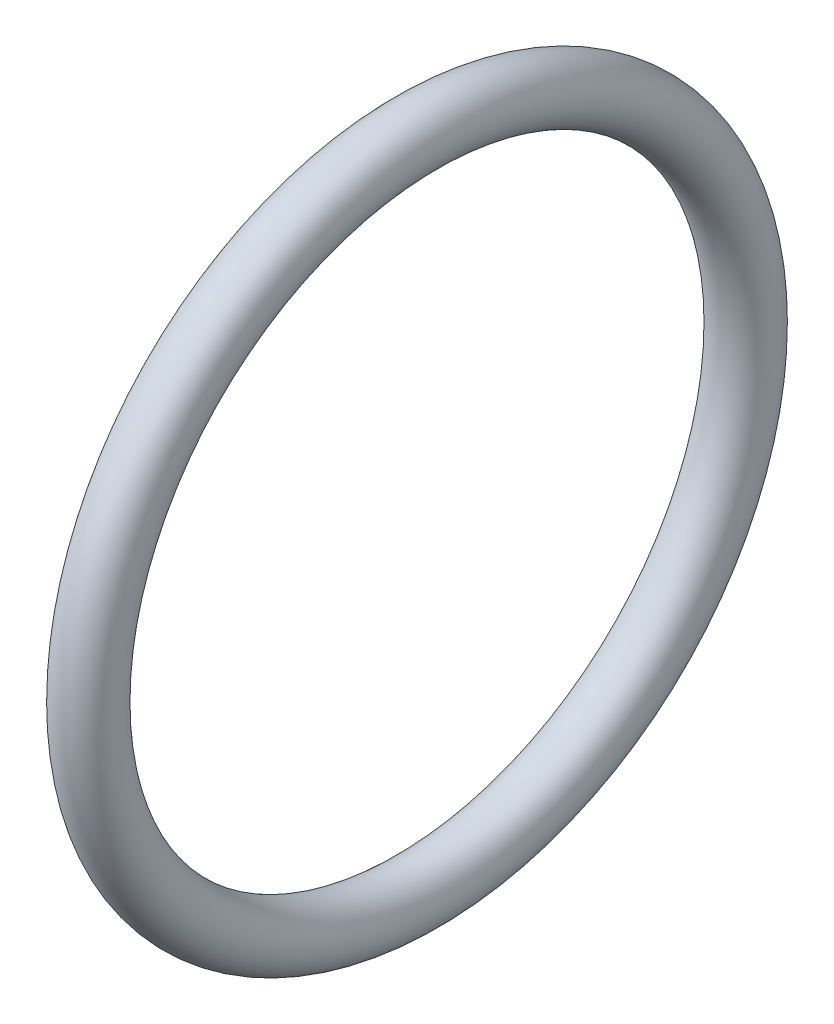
SolidWorks part; units mm, degrees
ref_plane "Plan1" through (0, 0, 0) normal (0, 0, 1) x (1, 0, 0)
ref_plane "Plan2" through (0, 0, 0) normal (0, 1, 0) x (1, 0, 0)
ref_plane "Plan3" through (0, 0, 0) normal (1, 0, 0) x (0, 0, -1)
sketch "Esquisse1" plane through (0, 0, 0) normal (0, 0, 1) x (1, 0, 0)
  line L0 (-50, 0) -> (60, 0) construction
  circle A0 centre (0, 19.5) radius 1.75
  dimension "D1" = 3.5
  dimension "D2" = 19.5
  dimension "D3" = 19.5
revolve "Base-Révolution" add sketch "Esquisse1" angle 360 about L0
